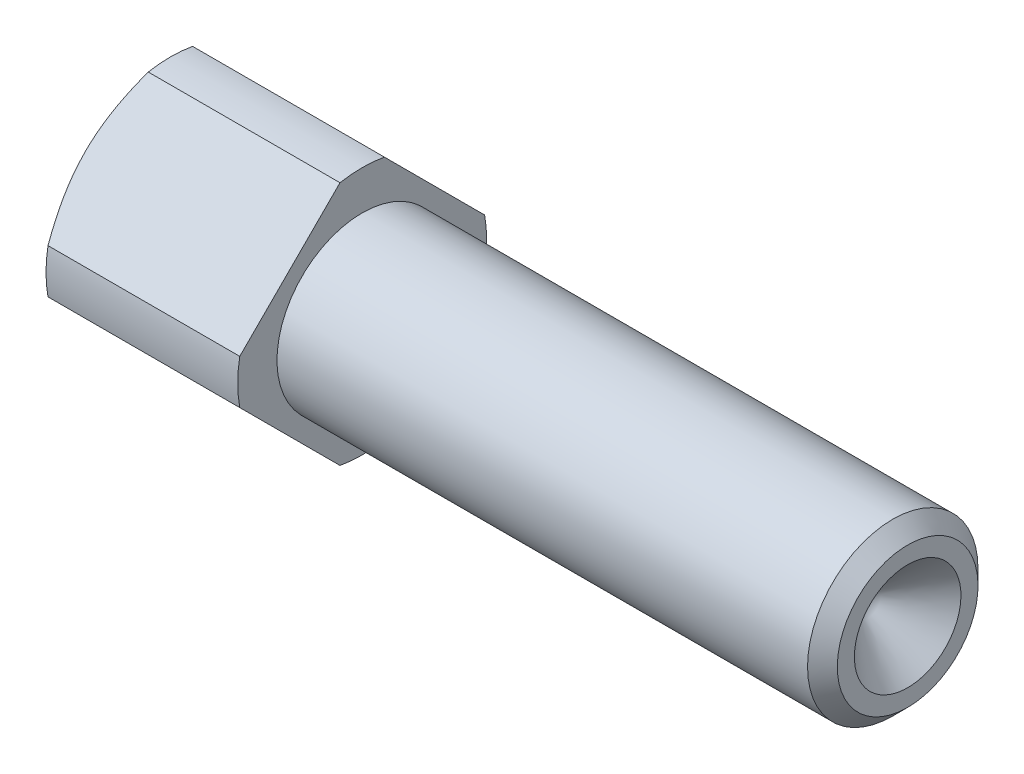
SolidWorks part; units mm, degrees
ref_plane "Front" through (0, 0, 0) normal (0, 0, 1) x (1, 0, 0)
ref_plane "Top" through (0, 0, 0) normal (0, 1, 0) x (1, 0, 0)
ref_plane "Right" through (0, 0, 0) normal (1, 0, 0) x (0, 0, -1)
other "Configuration Table"
sketch "Sketch1" plane through (0, 0, 0) normal (1, 0, 0) x (0, 0, -1)
  circle A0 centre (0, 0) radius 3.65
extrude "BaseHead" add sketch "Sketch1" along normal blind 6
sketch "Sketch2" plane through (0, -2.2415, -0.2463) normal (-1, 0, 0) x (0, 0, 1)
  line L1 (4.4889, 2.2415) -> (0.2463, 6.4841)
  line L2 (0.2463, 6.4841) -> (-3.9963, 2.2415)
  line L3 (-3.9963, 2.2415) -> (0.2463, -2.0012)
  line L4 (0.2463, -2.0012) -> (4.4889, 2.2415)
  circle A0 centre (0.2463, 2.2415) radius 3 construction
extrude "Cut-Extrude1" cut sketch "Sketch2" against normal blind 6 flip side to cut
sketch "Sketch3" plane through (1.2597, -5.2747, 0) normal (0, 0, 1) x (0, -1, 0)
  line L0 (-9.2897, -1.2597) -> (-8.2747, -1.2597)
  line L2 (-8.2747, -1.2597) -> (-9.2897, -0.6737)
  line L3 (-9.2897, -0.6737) -> (-9.2897, -1.2597)
  line L4 (-5.2747, 0.2856) -> (-5.2747, -6.82) construction
  line L6 (-8.8662, -1.2597) -> (-5.9259, -1.2597) construction
revolve "Cut-Revolve1" cut sketch "Sketch3" angle 360 about L4
sketch "Sketch4" plane through (-10.3472, 12.8472, 0) normal (0, 0, 1) x (0, -1, 0)
  line L0 (12.8472, 16.3472) -> (15.3472, 16.3472)
  line L1 (15.3472, 32.3472) -> (14.4106, 32.3472)
  line L2 (15.3472, 16.3472) -> (15.3472, 32.3472)
  line L3 (14.4106, 32.3472) -> (12.8472, 30.7839)
  line L4 (9.2558, 16.3472) -> (12.196, 16.3472) construction
  line L5 (12.8472, 30.7839) -> (12.8472, 16.3472)
  line L6 (12.8472, 24.434) -> (12.8472, -1.2396) construction
revolve "BaseBody" add sketch "Sketch4" angle 360 about L6
fillet "HeadFillet" [suppressed] radius 0.2
chamfer "Chamfer1" distance 0.4367 angle 45 1 edges at (22, 2.5, 0)
sketch "Sketch8" plane through (0, 0, 0) normal (0, 0, 1) x (1, 0, 0)
  line L0 (16, 2.067) -> (16.25, 2.5)
  line L1 (16.25, 2.5) -> (16.25, 3)
  line L2 (16.25, 3) -> (15.75, 3)
  line L3 (15.75, 3) -> (15.75, 2.5)
  line L4 (15.75, 2.5) -> (16, 2.067)
  line L5 (0, 0) -> (18.2989, 0) construction
  line L6 (0, 2.1213) -> (0, -2.1213) construction
  line L7 (22, -2.0633) -> (22, 2.0633) construction
revolve "Cut-Revolve10" [suppressed] cut sketch "Sketch8" angle 360 about L5
pattern_linear "LPattern10" [suppressed] count 10 spacing 0.6 along (1, 0, 0)
equation "\"d2@Sketch3\" = \"s@Sketch2\""
equation "\"D1@Sketch3\" = \"e@Sketch1\" * 1.1"
equation "\"k+c@BaseHead\" = \"k@Cut-Extrude1\""
equation "\"D1@Chamfer1\" = \"d@Sketch4\" / 2 - \"dz@Sketch4\" / 2-0.5"
equation "\"D1@Sketch8\" = \"d@Sketch4\""
equation "\"D3@Sketch8\" = \"D1@ThreadCosmetic1\""
equation "\"ss@Sketch8\" =  ( \"d@Sketch4\" - \"d@ThreadCosmetic1\" )  / 2"
equation "\"D3@LPattern10\" = \"ss@Sketch8\" * 1.2"
equation "\"D1@LPattern10\" = \"D1@ThreadCosmetic1\" / \"D3@LPattern10\""
